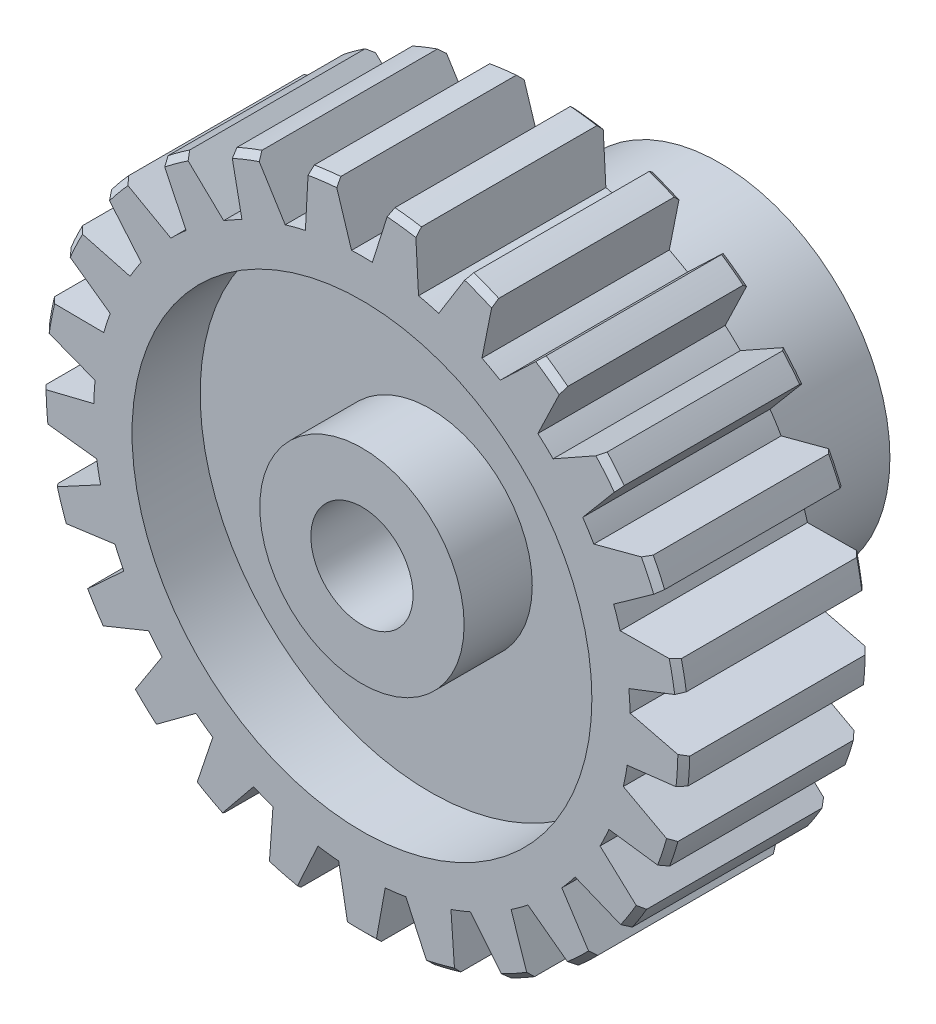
SolidWorks part; units mm, degrees
ref_plane "Plan1" through (0, 0, 0) normal (0, 0, 1) x (1, 0, 0)
ref_plane "Plan2" through (0, 0, 0) normal (0, 1, 0) x (1, 0, 0)
ref_plane "Plan3" through (0, 0, 0) normal (1, 0, 0) x (0, 0, -1)
sketch "Diamètre primitif" plane through (0, 0, 0) normal (0, 0, 1) x (1, 0, 0)
  line L0 (0, 0) -> (0.7, 0) construction
  circle A0 centre (0, 0) radius 8.75
  point P3 (0, 0)
  dimension "D1" = 17.5
  dimension "D2" = 0.7
sketch "Esquisse2" plane through (0, 0, 0) normal (0, 0, 1) x (1, 0, 0)
  circle A0 centre (0, 0) radius 9.45
  dimension "D1" = 18.9
extrude "Diamètre de tête" add sketch "Esquisse2" along normal mid plane 5.5
chamfer "Chanfreins" distance 0.175 angle 45
sketch "Esquisse3" plane through (0, 0, 0) normal (0, 0, 1) x (1, 0, 0)
  line L0 (0, 0) -> (0, 9.45) construction
  line L1 (-0.3058, 7.8691) -> (-0.7937, 9.4166)
  line L2 (0.3058, 7.8691) -> (0.7937, 9.4166)
  arc A0 (0.3058, 7.8691) -> (-0.3058, 7.8691) centre (0, 0) ccw
  circle A1 centre (0, 0) radius 9.45 construction
  arc A2 (0.7937, 9.4166) -> (-0.7937, 9.4166) centre (0, 0) ccw
  point P1 (-0.5498, 8.6428)
  point P10 (0.5498, 8.6428)
  dimension "D1" = 15.75
  dimension "D2" = 1.0996
  dimension "D3" = 325
extrude "Creux dent" cut sketch "Esquisse3" against normal through all and the other way through all
pattern_circular "Répétition" count 25 over 360
sketch "Esquisse4" plane through (0, 0, 2.75) normal (0, 0, 1) x (1, 0, 0)
  circle A0 centre (0, 0) radius 1.5
  dimension "D1" = 3
extrude "Passage axe" cut sketch "Esquisse4" against normal through all
sketch "Esquisse5" plane through (0, 0, 2.75) normal (0, 0, 1) x (1, 0, 0)
  circle A0 centre (0, 0) radius 3
  circle A1 centre (0, 0) radius 6.75
  dimension "D1" = 6
  dimension "D2" = 13.5
extrude "Gorge avant" cut sketch "Esquisse5" against normal blind 2
sketch "Esquisse6" plane through (0, 0, -2.75) normal (0, 0, -1) x (-1, 0, 0)
  circle A0 centre (0, 0) radius 6.75
  circle A1 centre (0, 0) radius 5
  dimension "D1" = 13.5
  dimension "D2" = 10
extrude "Gorge arrière" cut sketch "Esquisse6" against normal blind 1.5
sketch "Esquisse7" plane through (0, 0, -2.75) normal (0, 0, -1) x (-1, 0, 0)
  line L0 (3, 0) -> (0, 0) construction
  line L1 (-3, 3) -> (3, 3)
  line L2 (-3, 3) -> (-3, -3)
  line L3 (-3, -3) -> (3, -3)
  line L4 (3, 3) -> (3, -3)
  line L5 (0, 0) -> (0, -3) construction
  circle A1 centre (0, 0) radius 5
  circle A2 centre (0, 0) radius 5
  dimension "D2" = 6
  dimension "D1" = 0
extrude "Carré" add sketch "Esquisse7" along normal blind 5
equation "\"D1@Esquisse2\" = \"D1@Diamètre primitif\" + 2 * \"D2@Diamètre primitif\""
equation "\"D1@Chanfreins\" = 0.25*\"D2@Diamètre primitif\""
equation "\"D1@Esquisse3\" = \"D1@Diamètre primitif\"-2.5*\"D2@Diamètre primitif\""
equation "\"D2@Esquisse3\"=3.14159*\"D2@Diamètre primitif\"/2"
equation "\"D1@Répétition\" = \"D1@Diamètre primitif\"/\"D2@Diamètre primitif\""
